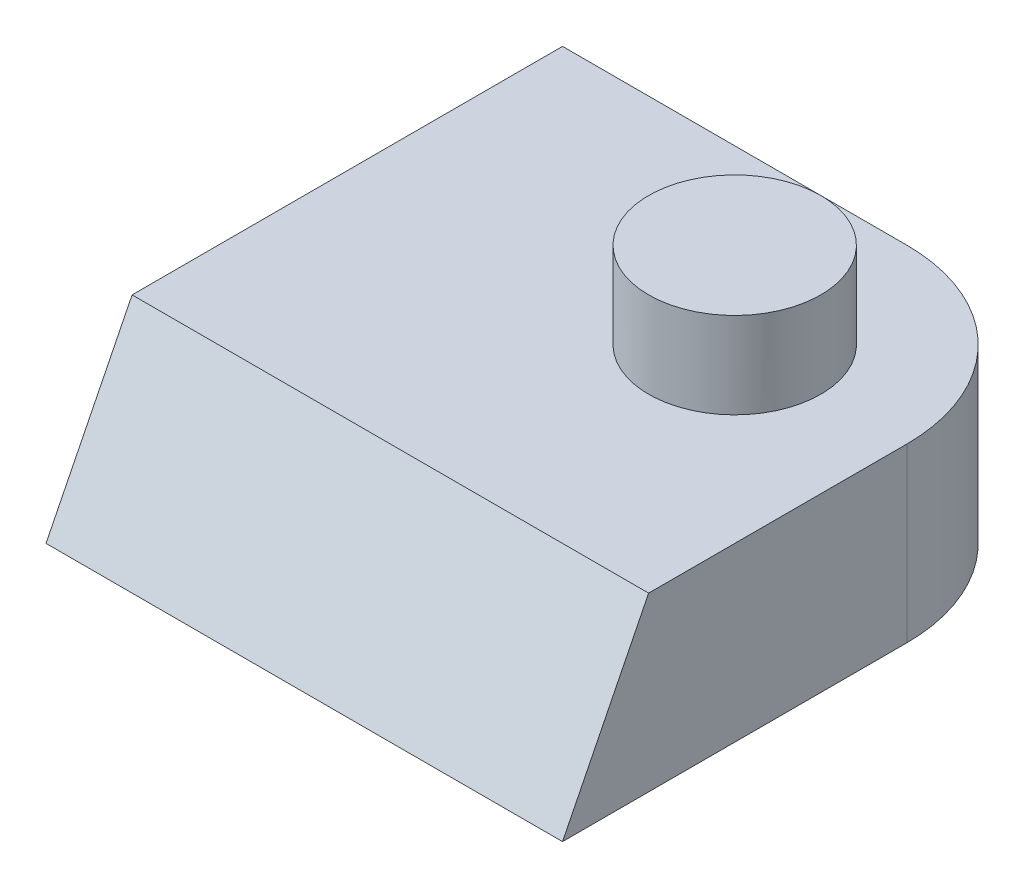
SolidWorks part; units mm, degrees
ref_plane "正面" through (0, 0, 0) normal (0, 0, 1) x (1, 0, 0)
ref_plane "平面" through (0, 0, 0) normal (0, 1, 0) x (1, 0, 0)
ref_plane "右側面" through (0, 0, 0) normal (1, 0, 0) x (0, 0, -1)
sketch "ｽｹｯﾁ2" plane through (0, 0, 0) normal (0, 1, 0) x (1, 0, 0)
  line L0 (30, 30) -> (-30, -30) construction
  line L1 (-30, -30) -> (30, -30)
  line L2 (-30, -30) -> (-30, 30)
  line L3 (-30, 30) -> (30, 30)
  line L4 (30, -30) -> (30, 30)
  dimension "D1" = 60
  dimension "D2" = 60
extrude "押し出し2" add sketch "ｽｹｯﾁ2" along normal blind 20
sketch "ｽｹｯﾁ3" plane through (30, 0, 0) normal (1, 0, 0) x (0, 0, -1)
  line L0 (-20, 20) -> (-30, 0)
  line L1 (-30, 20) -> (30, 20) construction
  line L2 (-30, 0) -> (-30, 20)
  line L3 (-30, 20) -> (-20, 20)
  dimension "D1" = 10
extrude "ｶｯﾄ - 押し出し1" cut sketch "ｽｹｯﾁ3" against normal through all
fillet "ﾌｨﾚｯﾄ1" radius 20 1 edges at (30, 10, -30)
sketch "ｽｹｯﾁ4" plane through (0, 20, 0) normal (0, 1, 0) x (1, 0, 0)
  circle A0 centre (10, 10) radius 10
  dimension "D1" = 20
extrude "押し出し3" add sketch "ｽｹｯﾁ4" along normal blind 10
